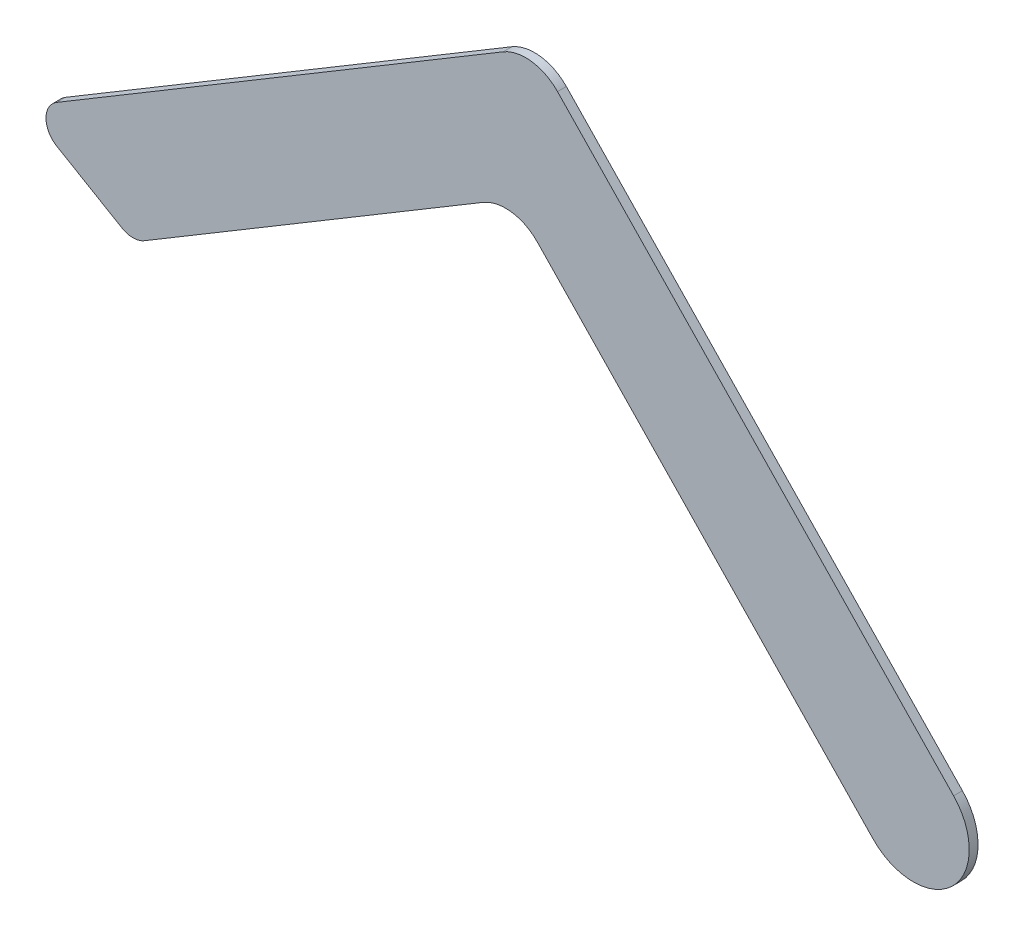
SolidWorks part; units mm, degrees
ref_plane "Ebene vorne" through (0, 0, 0) normal (0, 0, 1) x (1, 0, 0)
ref_plane "Ebene oben" through (0, 0, 0) normal (0, 1, 0) x (1, 0, 0)
ref_plane "Ebene rechts" through (0, 0, 0) normal (1, 0, 0) x (0, 0, -1)
sketch "Skizze1" plane through (0, 0, 0) normal (0, 0, 1) x (1, 0, 0)
  line L0 (-92.5767, 101.3455) -> (396.0899, 101.3455) construction
sketch "Skizze3" plane through (0, 0, 0) normal (0, 0, 1) x (1, 0, 0)
  line L0 (197.5055, 216.9532) -> (352.3085, 56.0021)
  line L2 (315.849, 20.6948) -> (188.3795, 153.2267)
  line L3 (163.6986, 156.5266) -> (10.0294, 64.6138)
  line L8 (-0.1659, 64.5718) -> (-29.6683, 81.8894)
  line L10 (-29.7392, 99.0955) -> (172.8245, 220.2531)
  line L11 (352.3085, 56.0021) -> (377.223, 30.0982)
  line L12 (315.849, 20.6948) -> (340.6433, -5.0843)
  arc A1 (172.8245, 220.2531) -> (197.5055, 216.9532) centre (183.0907, 203.0891) cw
  arc A2 (163.6986, 156.5266) -> (188.3795, 153.2267) centre (173.9648, 139.3625) cw
  arc A3 (-0.1659, 64.5718) -> (10.0294, 64.6138) centre (4.8963, 73.1959) ccw
  arc A4 (-29.7392, 99.0955) -> (-29.6683, 81.8894) centre (-24.6061, 90.5135) ccw
  arc A6 (340.6433, -5.0843) -> (377.223, 30.0982) centre (358.9331, 12.507) ccw
  point P1 (0, 0)
  dimension "D3" = 20
  dimension "D4" = 20
  dimension "D5" = 10
  dimension "D6" = 10
  dimension "D7" = 50.7534
  dimension "D1" = 103
  dimension "D2" = 103
extrude "Aufsatz-Linear austragen1" add sketch "Skizze3" along normal blind 4 contours L3 A3 L8 A4 L10 A1 L0 L11 A6 L12 L2 A2
scale "Skalieren1" scale about centroid uniform scaling yes scale factor 1.19
